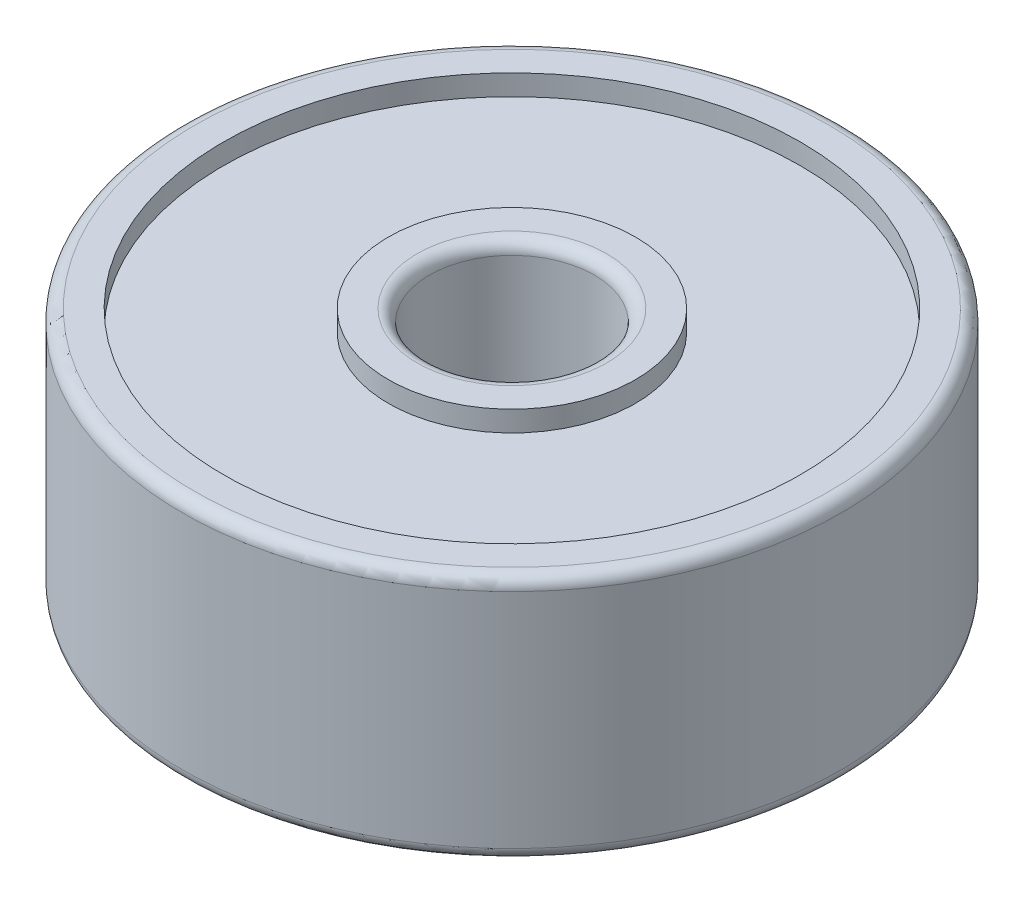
SolidWorks part; units mm, degrees
ref_plane "Спереди" through (0, 0, 0) normal (0, 0, 1) x (1, 0, 0)
ref_plane "Сверху" through (0, 0, 0) normal (0, 1, 0) x (1, 0, 0)
ref_plane "Справа" through (0, 0, 0) normal (1, 0, 0) x (0, 0, -1)
sketch "Эскиз1" plane through (0, 0, 0) normal (0, 0, 1) x (1, 0, 0)
  line L0 (0, 0) -> (0, 34.426) construction
  line L1 (0, 0) -> (-26.5532, 0) construction
  line L2 (-2, -2.7) -> (-2, 2.7)
  line L3 (-2.3, 3) -> (-3, 3)
  line L4 (-3, 3) -> (-3, 2.5)
  line L5 (-3, 2.5) -> (-7, 2.5)
  line L6 (-7, 2.5) -> (-7, 3)
  line L7 (-7, 3) -> (-7.7, 3)
  line L8 (-8, 2.7) -> (-8, -2.7)
  line L9 (-7, -3) -> (-7.7, -3)
  line L10 (-7, -2.5) -> (-7, -3)
  line L11 (-3, -2.5) -> (-7, -2.5)
  line L12 (-3, -3) -> (-3, -2.5)
  line L13 (-2.3, -3) -> (-3, -3)
  arc A0 (-2.3, -3) -> (-2, -2.7) centre (-2.3, -2.7) ccw
  arc A1 (-7.7, -3) -> (-8, -2.7) centre (-7.7, -2.7) cw
  arc A2 (-2, 2.7) -> (-2.3, 3) centre (-2.3, 2.7) ccw
  arc A3 (-7.7, 3) -> (-8, 2.7) centre (-7.7, 2.7) ccw
  point P13 (-8, 0)
  point P18 (-2, 0)
  point P20 (-2, -3)
  point P23 (-8, -3)
  point P26 (-2, 3)
  point P29 (-8, 3)
  dimension "D7" = 0.3
  dimension "D1" = 4
  dimension "D2" = 1
  dimension "D3" = 1
  dimension "D4" = 0.5
  dimension "D5" = 16
  dimension "D6" = 3
revolve "Повернуть1" add sketch "Эскиз1" angle 360 about L0
